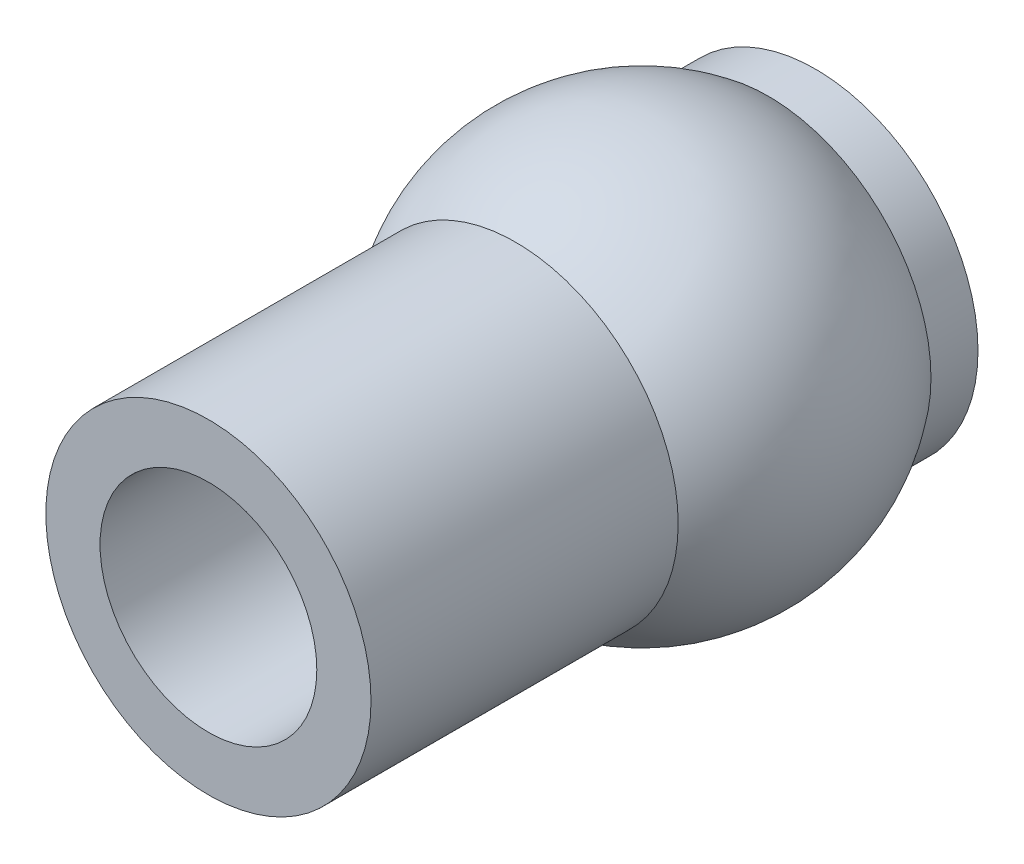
SolidWorks part; units mm, degrees
ref_plane "Front Plane" through (0, 0, 0) normal (0, 0, 1) x (1, 0, 0)
ref_plane "Top Plane" through (0, 0, 0) normal (0, 1, 0) x (1, 0, 0)
ref_plane "Right Plane" through (0, 0, 0) normal (1, 0, 0) x (0, 0, -1)
sketch "Sketch1" plane through (0, 0, 0) normal (0, 0, 1) x (1, 0, 0)
  line L0 (0, 3.2214) -> (0, -3.7604) construction
  line L1 (0, -2.413) -> (0, 2.413)
  arc A0 (0, 2.413) -> (0, -2.413) centre (0, 0) ccw
  dimension "D1" = 4.826
revolve "Revolve1" add sketch "Sketch1" angle 360 about L0
sketch "Sketch2" plane through (0, 0, 0) normal (0, 0, 1) x (1, 0, 0)
  circle A0 centre (0, 0) radius 1.905
  dimension "D1" = 3.81
extrude "Boss-Extrude1" add sketch "Sketch2" along normal blind 5.08 and the other way blind 2.032
sketch "Sketch3" plane through (0, 0, 5.08) normal (0, 0, 1) x (1, 0, 0)
  circle A0 centre (0, 0) radius 1.27
  dimension "D1" = 2.54
extrude "Cut-Extrude1" cut sketch "Sketch3" against normal through all
